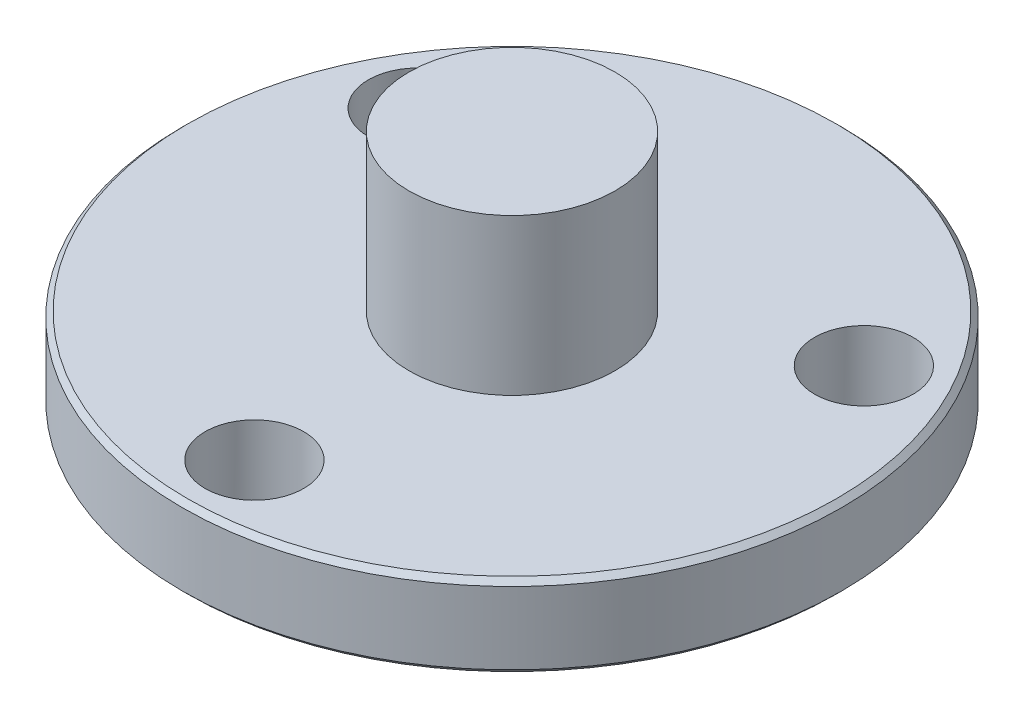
SolidWorks part; units mm, degrees
ref_plane "Front Plane" through (0, 0, 0) normal (0, 0, 1) x (1, 0, 0)
ref_plane "Top Plane" through (0, 0, 0) normal (0, 1, 0) x (1, 0, 0)
ref_plane "Right Plane" through (0, 0, 0) normal (1, 0, 0) x (0, 0, -1)
sketch "Sketch1" plane through (0, 0, 0) normal (0, 1, 0) x (1, 0, 0)
  circle A0 centre (0, 0) radius 3.9688
  dimension "D1" = 7.9375
extrude "Boss-Extrude1" add sketch "Sketch1" along normal blind 70
sketch "Sketch2" plane through (0, 0, 0) normal (0, -1, 0) x (1, 0, 0)
  circle A0 centre (0, 0) radius 12.7
  dimension "D1" = 25.4
extrude "Boss-Extrude2" add sketch "Sketch2" against normal blind 3.18 from offset 15.3188
chamfer "Chamfer1" distance 0.2 angle 45 1 edges at (0, 18.4988, -12.7)
chamfer "Chamfer2" distance 0.2 angle 45 1 edges at (0, 15.3188, -12.7)
chamfer "Chamfer3" distance 0.2 angle 45 1 edges at (0, 70, 3.9688)
hole_wizard "#6 Clearance Hole1" positions "Sketch10" profile "Sketch9" hole size "#6" standard "ANSI Inch"
sketch "Sketch10" plane through (0, 18.4988, 0) normal (0, 1, 0) x (1, 0, 0)
  line L0 (0, 0) -> (0, -9.9219) construction
  point P0 (0, -9.9219)
  dimension "D1" = 9.9219
sketch "Sketch9" plane through (0, 18.4988, 9.9219) normal (1, 0, 0) x (0, 0, 1)
  line L0 (0, 0) -> (0, 10.1408)
  line L1 (0, 10.1408) -> (1.8986, 9)
  line L2 (1.8986, 9) -> (1.8986, 0)
  line L5 (1.8986, 0) -> (0, 0)
  line L10 (0, 10.1408) -> (-1.8987, 9) construction
  line L11 (0, -6.35) -> (0, 107.95) construction
  dimension "Hole Dia." = 3.7973
  dimension "Hole Depth" = 9
  dimension "Drill Angle" = 118
pattern_circular "CirPattern1" count 3 every 120 about axis through (0, 0, 0) along (0, 1, 0) of "#6 Clearance Hole1"
sketch "Sketch11" plane through (0, 15.3188, 0) normal (0, -1, 0) x (1, 0, 0)
  circle A0 centre (0, 0) radius 12.5
extrude "Cut-Extrude1" cut sketch "Sketch11" along normal through all
sketch "Sketch12" plane through (0, 18.4988, 0) normal (0, 1, 0) x (1, 0, 0)
  circle A0 centre (0, 0) radius 12.5
extrude "Cut-Extrude2" cut sketch "Sketch12" along normal through all from offset 6
